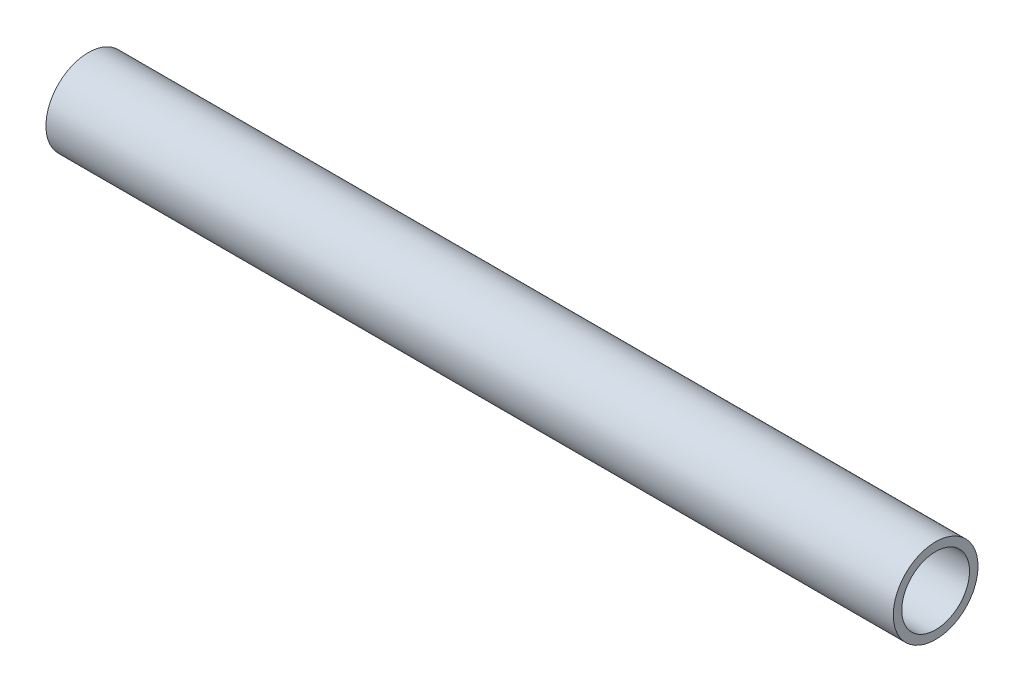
SolidWorks part; units mm, degrees
ref_plane "Front Plane" through (0, 0, 0) normal (0, 0, 1) x (1, 0, 0)
ref_plane "Top Plane" through (0, 0, 0) normal (0, 1, 0) x (1, 0, 0)
ref_plane "Right Plane" through (0, 0, 0) normal (1, 0, 0) x (0, 0, -1)
sketch "Sketch1" plane through (0, 0, 0) normal (1, 0, 0) x (0, 0, -1)
  circle A0 centre (0, 0) radius 12.5
  circle A1 centre (0, 0) radius 10
  dimension "D1" = 25
  dimension "D2" = 20
extrude "Boss-Extrude1" add sketch "Sketch1" along normal blind 250
